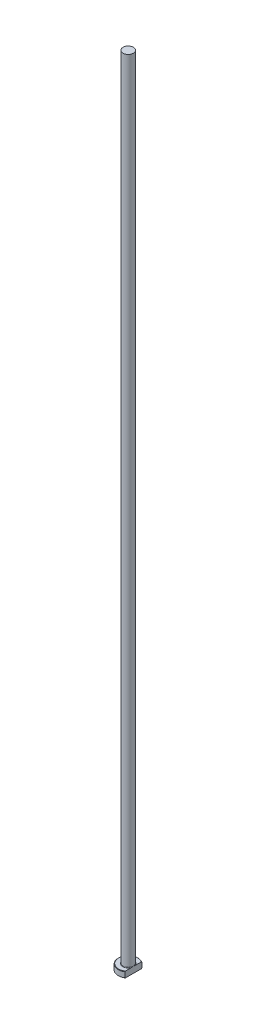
SolidWorks part; units mm, degrees
ref_plane "Front Plane" through (0, 0, 0) normal (0, 0, 1) x (1, 0, 0)
ref_plane "Top Plane" through (0, 0, 0) normal (0, 1, 0) x (1, 0, 0)
ref_plane "Right Plane" through (0, 0, 0) normal (1, 0, 0) x (0, 0, -1)
sketch "Sketch1" plane through (0, 0, 0) normal (0, 0, 1) x (1, 0, 0)
  line L0 (0, 259.9588) -> (0, -15.1925) construction
  line L1 (0, 0) -> (-5, 0)
  line L2 (-5, 0) -> (-5, 3)
  line L3 (-5, 3) -> (-2.6, 3)
  line L4 (-2.6, 3) -> (-2.6, 400)
  line L5 (-2.6, 400) -> (0, 400)
  line L6 (0, 400) -> (0, 0)
  dimension "L" = 400
  dimension "H" = 10
  dimension "T" = 3
  dimension "D" = 5.2
revolve "Revolve1" add sketch "Sketch1" angle 360 about L0
chamfer "Chamfer1" distance 0.2 angle 45 2 edges at (0, 3, 5) (0, 0, 5)
fillet "Fillet1" radius 0.2 1 edges at (0, 3, 2.6)
sketch "Sketch2" plane through (0, 0, 0) normal (0, 1, 0) x (1, 0, 0)
  line L0 (2.6, 4.2708) -> (2.6, -4.2708)
  circle A0 centre (0, 0) radius 5 construction
  arc A1 (2.6, -4.2708) -> (2.6, 4.2708) centre (0, 0) ccw
  circle A2 centre (0, 0) radius 2.6 construction
extrude "KEY" cut sketch "Sketch2" along normal through all
